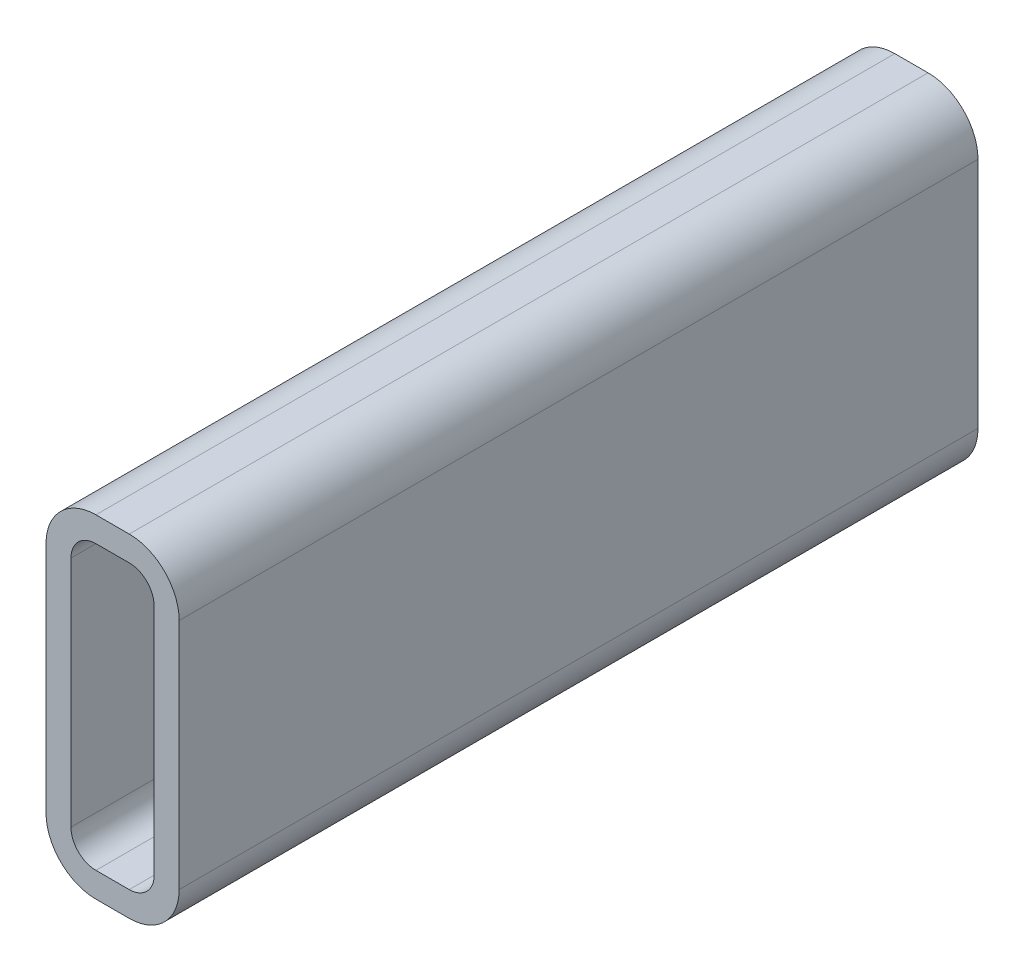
SolidWorks part; units mm, degrees
ref_plane "Front Plane" through (0, 0, 0) normal (0, 0, 1) x (1, 0, 0)
ref_plane "Top Plane" through (0, 0, 0) normal (0, 1, 0) x (1, 0, 0)
ref_plane "Right Plane" through (0, 0, 0) normal (1, 0, 0) x (0, 0, -1)
sketch "Sketch1" plane through (0, 0, 0) normal (0, 0, 1) x (1, 0, 0)
  line B0 (19.05, 127) -> (31.75, 127)
  arc B1 (50.8, 107.95) -> (31.75, 127) centre (31.75, 107.95) ccw
  line B2 (50.8, 107.95) -> (50.8, 19.05)
  arc B3 (31.75, 0) -> (50.8, 19.05) centre (31.75, 19.05) ccw
  line B4 (31.75, 0) -> (19.05, 0)
  arc B5 (0, 19.05) -> (19.05, 0) centre (19.05, 19.05) ccw
  line B6 (0, 19.05) -> (0, 107.95)
  arc B7 (19.05, 127) -> (0, 107.95) centre (19.05, 107.95) ccw
  line B8 (19.05, 117.475) -> (31.75, 117.475)
  arc B9 (41.275, 107.95) -> (31.75, 117.475) centre (31.75, 107.95) ccw
  line B10 (41.275, 107.95) -> (41.275, 19.05)
  arc B11 (31.75, 9.525) -> (41.275, 19.05) centre (31.75, 19.05) ccw
  line B12 (31.75, 9.525) -> (19.05, 9.525)
  arc B13 (9.525, 19.05) -> (19.05, 9.525) centre (19.05, 19.05) ccw
  line B14 (9.525, 19.05) -> (9.525, 107.95)
  arc B15 (19.05, 117.475) -> (9.525, 107.95) centre (19.05, 107.95) ccw
sketch_block_instance "HSS5x2x0.375-1"
sketch_block "HSS5x2x0.375"
extrude "Boss-Extrude1" add sketch "Sketch1" along normal blind 304.8
